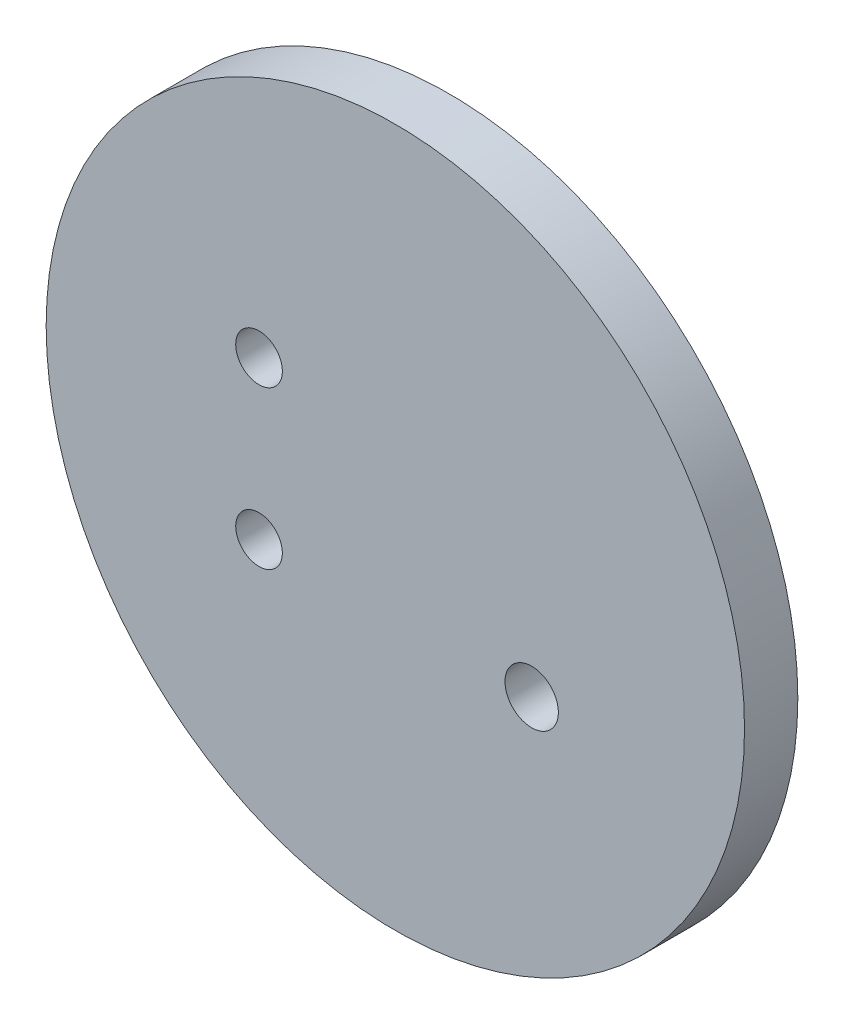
SolidWorks part; units mm, degrees
ref_plane "Front Plane" through (0, 0, 0) normal (0, 0, 1) x (1, 0, 0)
ref_plane "Top Plane" through (0, 0, 0) normal (0, 1, 0) x (1, 0, 0)
ref_plane "Right Plane" through (0, 0, 0) normal (1, 0, 0) x (0, 0, -1)
imported_body "Imported1"
sketch "Sketch2" [suppressed] plane through (0, 0, 0) normal (1, 0, 0) x (0, 0, -1)
  line L0 (0.9514, -73.3542) -> (0.9514, 73.3389) construction
  line L1 (-67.6839, 107.4954) -> (-18.0986, 107.4954)
  line L2 (-67.6839, 107.4954) -> (-67.6839, -95.5682)
  line L3 (-67.6839, -95.5682) -> (-18.0986, -95.5682)
  line L4 (-18.0986, 107.4954) -> (-18.0986, -95.5682)
  dimension "D1" = 19.05
extrude "Cut-Extrude2" [suppressed] cut sketch "Sketch2" against normal through all both and the other way through all
sketch "Sketch1" plane through (0, 0, 0) normal (1, 0, 0) x (0, 0, -1)
  line L1 (-23.65, 85.4621) -> (52.55, 85.4621)
  line L2 (-23.65, 85.4621) -> (-23.65, -88.7576)
  line L3 (-23.65, -88.7576) -> (52.55, -88.7576)
  line L4 (52.55, 85.4621) -> (52.55, -88.7576)
  dimension "D1" = 76.2
extrude "Cut-Extrude1" cut sketch "Sketch1" against normal through all both and the other way through all
sketch "Sketch3" [suppressed] plane through (0, 0, 18.0986) normal (0, 0, 1) x (1, 0, 0)
  circle A0 centre (0, 0) radius 76.835
  circle A1 centre (0, 0) radius 83.185
  dimension "D1" = 166.37
  dimension "D2" = 6.35
extrude "Boss-Extrude1" [suppressed] add sketch "Sketch3" along normal up to surface (104.775 mm away)
sketch "Sketch6" [suppressed] plane through (0, 0, -0.9514) normal (0, 0, -1) x (-1, 0, 0)
  circle A0 centre (0, 0) radius 83.185
sketch "Sketch7" [suppressed] plane through (0, 0, -0.9514) normal (0, 0, -1) x (-1, 0, 0)
  circle A0 centre (0, 0) radius 120.7069
extrude "Cut-Extrude4" [suppressed] cut sketch "Sketch7" against normal offset from surface (73.025 mm away) 50.8
sketch "Sketch8" [suppressed] plane through (0, 0, 72.0736) normal (0, 0, -1) x (-1, 0, 0)
  circle A0 centre (0, 0) radius 83.185
  circle A1 centre (0, 0) radius 76.835
  dimension "D1" = 166.37
  dimension "D2" = 6.35
sketch "Sketch9" plane through (0, 0, 23.65) normal (0, 0, -1) x (-1, 0, 0)
  circle A0 centre (0, 0) radius 83.185
extrude "Cut-Extrude5" cut sketch "Sketch9" against normal up to surface (4.4668 mm away)
sketch "Sketch10" plane through (0, 0, 48.3168) normal (0, 0, 1) x (1, 0, 0)
  circle A1 centre (0, 0) radius 91.8816
extrude "Cut-Extrude6" cut sketch "Sketch10" against normal up to surface (7 mm away)
sketch "Sketch11" plane through (0, 0, 28.1168) normal (0, 0, -1) x (-1, 0, 0)
  circle A0 centre (-1.9197, 0) radius 85.1047
  circle A1 centre (0, 0) radius 1.9197 construction
  circle A2 centre (-1.9197, 0) radius 65.4607
extrude "Boss-Extrude2" add sketch "Sketch11" against normal up to surface (13.2 mm away)
sketch "Sketch13" plane through (0, 0, 28.1168) normal (0, 0, -1) x (-1, 0, 0)
  circle A0 centre (0, 0) radius 87.0244
  circle A1 centre (0, 0) radius 83.185
extrude "Cut-Extrude7" cut sketch "Sketch13" against normal through all
sketch "Sketch15" plane through (0, 0, 41.3168) normal (0, 0, 1) x (1, 0, 0)
  circle A1 centre (0, -15.9222) radius 4.5093
  circle A2 centre (0, 15.7632) radius 5.1198
extrude "Boss-Extrude3" add sketch "Sketch15" against normal up to surface (10 mm away)
sketch "Sketch16" plane through (0, 0, 28.1168) normal (0, 0, -1) x (-1, 0, 0)
  circle A0 centre (-19.5, -48.5) radius 1.65
  circle A1 centre (19.5, -48.5) radius 1.65
  circle A2 centre (52, 0) radius 1.65
  circle A3 centre (-52, 0) radius 1.65
extrude "Boss-Extrude4" add sketch "Sketch16" against normal up to surface (13.2 mm away)
sketch "Sketch17" plane through (0, 0, 41.3168) normal (0, 0, 1) x (1, 0, 0)
  circle A0 centre (0, 0) radius 5.1434
extrude "Boss-Extrude5" add sketch "Sketch17" against normal through all
sketch "Sketch18" plane through (0, 0, 28.1168) normal (0, 0, -1) x (-1, 0, 0)
  circle A0 centre (-32.476, 18.75) radius 6.5481
  circle A1 centre (-32.476, 18.75) radius 6.35
extrude "Boss-Extrude6" add sketch "Sketch18" against normal up to surface (13.2 mm away)
sketch "Sketch19" plane through (0, 0, 28.1168) normal (0, 0, -1) x (-1, 0, 0)
  circle A0 centre (32.476, 18.75) radius 5.5562
  circle A1 centre (32.476, -18.75) radius 5.5562
  circle A2 centre (32.476, -18.75) radius 4.9606
  circle A3 centre (32.476, 18.75) radius 4.9606
  dimension "D1" = 11.1125
  dimension "D2" = 11.1125
extrude "Cut-Extrude8" cut sketch "Sketch19" against normal up to surface (13.2 mm away)
sketch "Sketch20" plane through (0, 0, 28.1168) normal (0, 0, -1) x (-1, 0, 0)
  line L0 (0, 0) -> (32.476, 18.75)
  line L1 (-32.476, 18.75) -> (0, 0)
  line L2 (0, 0) -> (32.476, -18.75)
  line L3 (0, 0) -> (-32.476, -18.75)
  circle A1 centre (0, 0) radius 37.5
  circle A2 centre (-32.476, -18.75) radius 6.35
  dimension "D2" = 12.7
  dimension "D1" = 60
extrude "Cut-Extrude9" cut sketch "Sketch20" against normal through all contours A1 A2 | A1 A2 L3 | L3 A2 A1
sketch "Sketch21" plane through (0, 0, 28.1168) normal (0, 0, -1) x (-1, 0, 0)
  circle A0 centre (-32.476, 18.75) radius 6.35
extrude "Boss-Extrude7" add sketch "Sketch21" against normal through all
sketch "Sketch22" plane through (0, 0, 41.3168) normal (0, 0, 1) x (1, 0, 0)
  line L0 (32.476, -18.75) -> (-32.476, -18.75)
  line L1 (0, -18.75) -> (0, -83.185)
  circle A0 centre (0, 0) radius 83.185 construction
ref_plane "Plane1" through (0, 0, 0) normal (1, 0, 0) x (0, -1, 0)
sketch "Sketch23" plane through (0, 0, 0) normal (1, 0, 0) x (0, -1, 0)
  line L0 (83.185, -28.1168) -> (70.485, -28.1168)
  line L2 (83.185, -28.1168) -> (-83.185, -28.1168) construction
  line L3 (70.485, -28.1168) -> (70.485, -21.1318)
  line L4 (70.485, -21.1318) -> (63.5, -28.1168)
  line L5 (63.5, -28.1168) -> (70.485, -28.1168)
  line L6 (0, -28.1168) -> (0, 20.1559)
  dimension "D1" = 12.7
  dimension "D2" = 6.985
  dimension "D3" = 45
revolve "Revolve1" [suppressed] add sketch "Sketch23" angle 360 about L6
sketch "Sketch24" plane through (0, 0, 41.3168) normal (0, 0, 1) x (1, 0, 0)
  circle A0 centre (0, 0) radius 83.185
extrude "Cut-Extrude10" cut sketch "Sketch24" against normal offset from surface (0.5 mm away) 12.7
